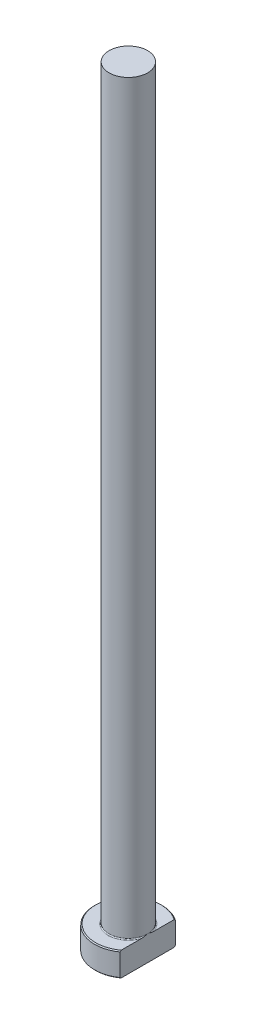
SolidWorks part; units mm, degrees
ref_plane "Front Plane" through (0, 0, 0) normal (0, 0, 1) x (1, 0, 0)
ref_plane "Top Plane" through (0, 0, 0) normal (0, 1, 0) x (1, 0, 0)
ref_plane "Right Plane" through (0, 0, 0) normal (1, 0, 0) x (0, 0, -1)
sketch "Sketch1" plane through (0, 0, 0) normal (0, 0, 1) x (1, 0, 0)
  line L0 (0, 259.9588) -> (0, -15.1925) construction
  line L1 (0, 0) -> (-7, 0)
  line L2 (-7, 0) -> (-7, 5)
  line L3 (-7, 5) -> (-4, 5)
  line L4 (-4, 5) -> (-4, 160)
  line L5 (-4, 160) -> (0, 160)
  line L6 (0, 160) -> (0, 0)
  dimension "L" = 160
  dimension "H" = 14
  dimension "T" = 5
  dimension "D" = 8
revolve "Revolve1" add sketch "Sketch1" angle 360 about L0
chamfer "Chamfer1" distance 0.2 angle 45 2 edges at (0, 5, 7) (0, 0, 7)
fillet "Fillet1" radius 0.2 1 edges at (0, 5, 4)
sketch "Sketch2" plane through (0, 0, 0) normal (0, 1, 0) x (1, 0, 0)
  line L0 (4, 5.7446) -> (4, -5.7446)
  circle A0 centre (0, 0) radius 7 construction
  arc A1 (4, -5.7446) -> (4, 5.7446) centre (0, 0) ccw
  circle A2 centre (0, 0) radius 4 construction
extrude "KEY" cut sketch "Sketch2" along normal through all
